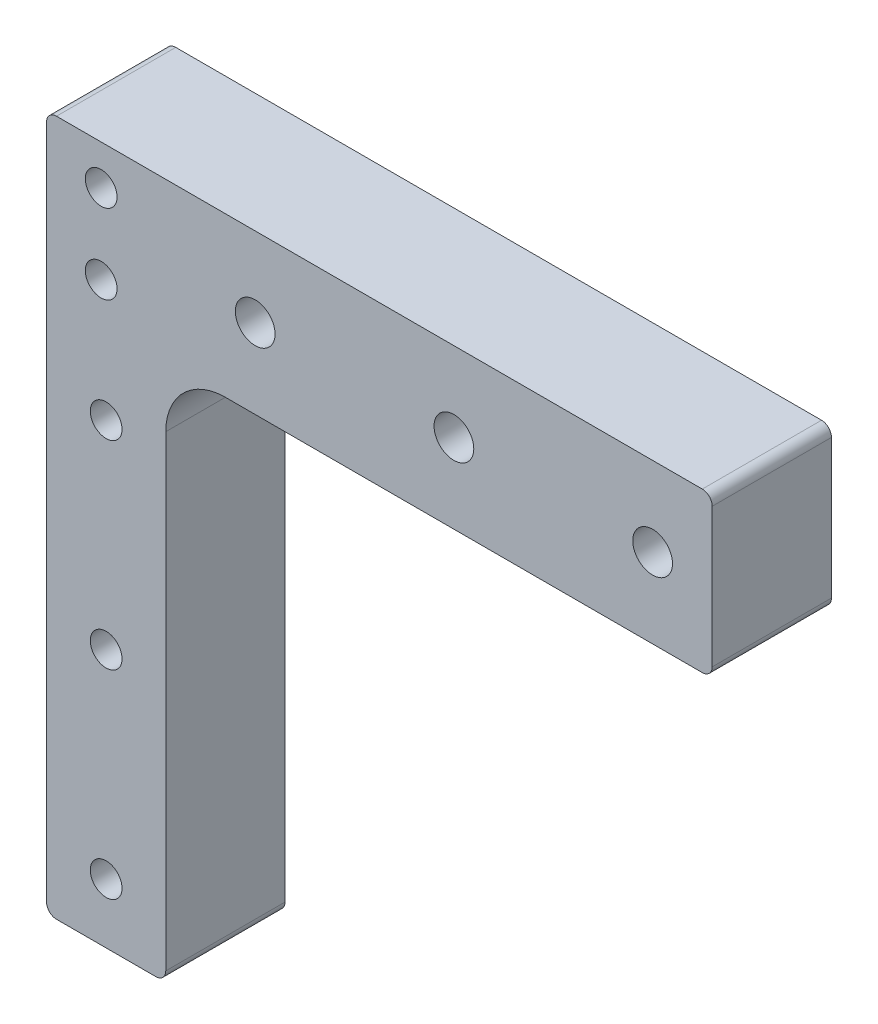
SolidWorks part; units mm, degrees
ref_plane "前视基准面" through (0, 0, 0) normal (0, 0, 1) x (1, 0, 0)
ref_plane "上视基准面" through (0, 0, 0) normal (0, 1, 0) x (1, 0, 0)
ref_plane "右视基准面" through (0, 0, 0) normal (1, 0, 0) x (0, 0, -1)
other "Configuration Table"
sketch "草图1" plane through (0, 0, 0) normal (0, 0, 1) x (1, 0, 0)
  line L0 (0, 0) -> (20, 0) construction
  line L1 (46, 8) -> (-21, 8)
  line L2 (-21, 8) -> (-21, -62)
  line L3 (-21, -62) -> (-9, -62)
  line L4 (-9, -62) -> (-9, -8)
  line L5 (-9, -8) -> (46, -8)
  line L6 (-15, -56) -> (-15, -36) construction
  line L7 (46, 8) -> (46, -8)
  circle A0 centre (0, 0) radius 1.6
  circle A1 centre (20, 0) radius 1.6
  circle A2 centre (40, 0) radius 1.6
  circle A8 centre (-15.5, -4) radius 1.6
  circle A9 centre (-15.5, 4) radius 1.6
  circle A10 centre (-15, -56) radius 1.6
  circle A11 centre (-15, -36) radius 1.6
  circle A12 centre (-15, -16) radius 1.6
  dimension "D3" = 3.2
  dimension "D4" = 8
  dimension "D10" = 3.2
  dimension "D8" = 8
  dimension "D15" = 3.2
  dimension "D1" = 20
  dimension "D5" = 12
  dimension "D6" = 9
  dimension "D7" = 70
  dimension "D9" = 4
  dimension "D11" = 6.5
  dimension "D13" = 20
  dimension "D14" = 6
  dimension "D16" = 6
  dimension "D17" = 8
  dimension "D18" = 6
  dimension "D2" = 3
  dimension "D12" = 3
extrude "凸台-拉伸1" add sketch "草图1" along normal blind 12
fillet "圆角1" radius 6 1 edges at (-9, -8, 6)
fillet "圆角2" radius 1 5 edges at (-21, 8, 6) (-21, -62, 6) (-9, -62, 6) (46, -8, 6) (46, 8, 6)
sketch "草图3" plane through (0, 0, 12) normal (0, 0, 1) x (1, 0, 0)
  line L0 (0, 0) -> (20, 0) construction
  circle A0 centre (0, 0) radius 2
  circle A2 centre (20, 0) radius 2
  circle A3 centre (40, 0) radius 2
  dimension "D1" = 4
  dimension "D2" = 3
  dimension "D3" = 20
extrude "切除-拉伸2" cut sketch "草图3" against normal blind 5
sketch "草图4" plane through (0, 0, 0) normal (0, 0, -1) x (-1, 0, 0)
  line L0 (0, 0) -> (-20, 0) construction
  circle A0 centre (0, 0) radius 2
  circle A1 centre (-20, 0) radius 2
  circle A2 centre (-40, 0) radius 2
  dimension "D1" = 4
  dimension "D2" = 3
  dimension "D3" = 20
extrude "切除-拉伸3" cut sketch "草图4" against normal blind 5
